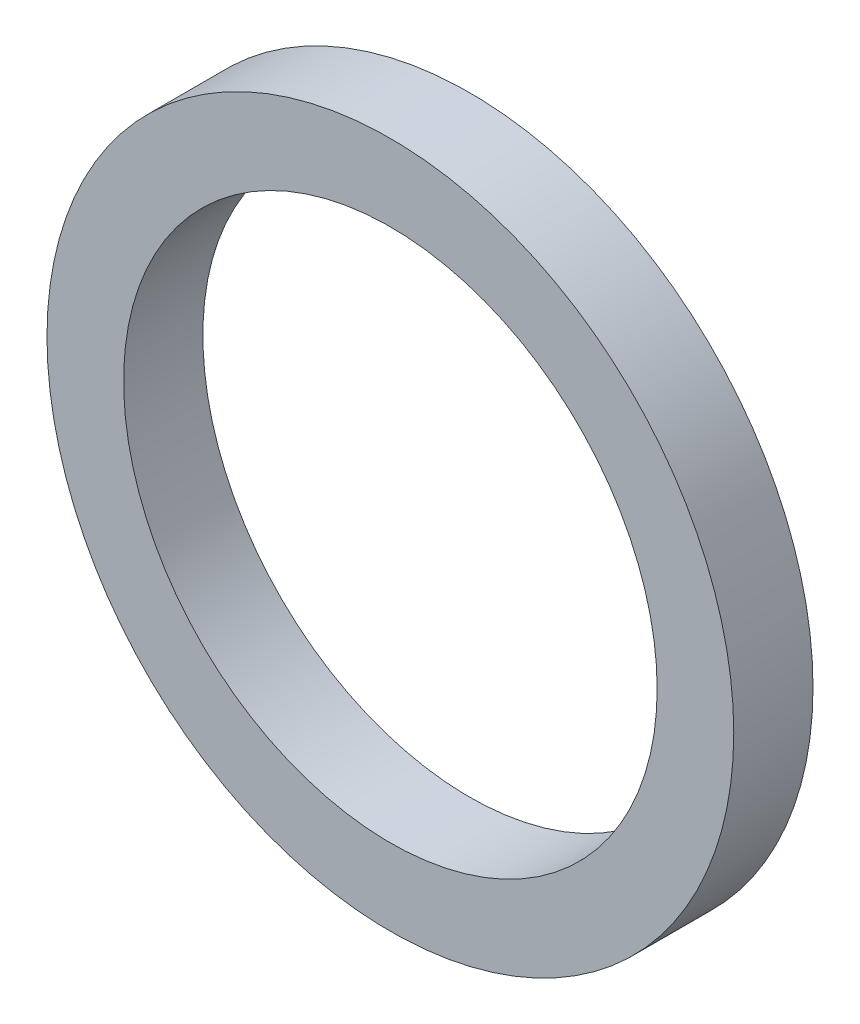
SolidWorks part; units mm, degrees
ref_plane "前视基准面" through (0, 0, 0) normal (0, 0, 1) x (1, 0, 0)
ref_plane "上视基准面" through (0, 0, 0) normal (0, 1, 0) x (1, 0, 0)
ref_plane "右视基准面" through (0, 0, 0) normal (1, 0, 0) x (0, 0, -1)
other "Configuration Table"
sketch "草图1" plane through (0, 0, 0) normal (0, 0, 1) x (1, 0, 0)
  circle A0 centre (0, 0) radius 13
  circle A1 centre (0, 0) radius 10.1
  dimension "D1" = 20.2
  dimension "D2" = 26
extrude "Wrist_Axial_Spacer_3mm" add sketch "草图1" against normal mid plane 3
